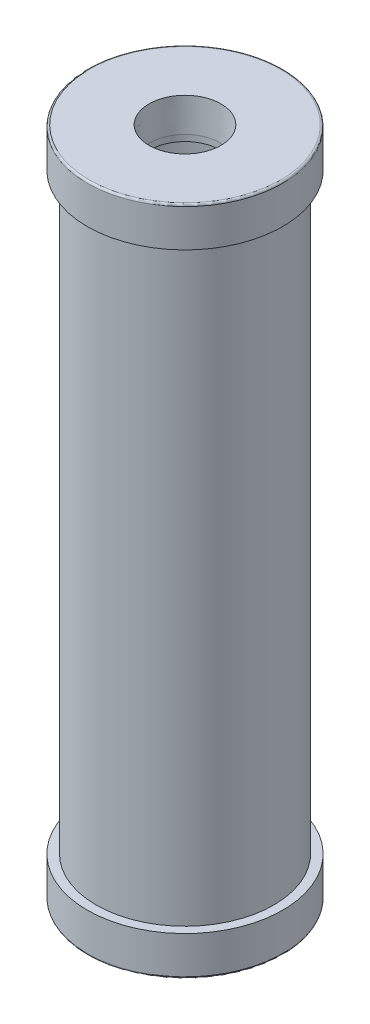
SolidWorks part; units mm, degrees
ref_plane "Front Plane" through (0, 0, 0) normal (0, 0, 1) x (1, 0, 0)
ref_plane "Top Plane" through (0, 0, 0) normal (0, 1, 0) x (1, 0, 0)
ref_plane "Right Plane" through (0, 0, 0) normal (1, 0, 0) x (0, 0, -1)
sketch "Sketch1" plane through (0, 0, 0) normal (0, 1, 0) x (1, 0, 0)
  circle A0 centre (0, 0) radius 57.15
  circle A1 centre (0, 0) radius 50.546
  dimension "D1" = 114.3
  dimension "D2" = 6.604
extrude "Boss-Extrude1" add sketch "Sketch1" along normal blind 431.8
sketch "Sketch2" plane through (0, 0, 0) normal (0, 1, 0) x (1, 0, 0)
  circle A0 centre (0, 0) radius 62.865
  dimension "D1" = 125.73
extrude "Boss-Extrude2" add sketch "Sketch2" along normal blind 25.4
hole_wizard "1-1/2 Rc Tapped Hole1" positions "Sketch4" profile "Sketch3" size "1-1/2" standard "BSI"
sketch "Sketch4" plane through (0, 0, 0) normal (0, 1, 0) x (1, 0, 0)
  point P0 (0, 0)
sketch "Sketch3" plane through (0, 0, 0) normal (1, 0, 0) x (0, 0, -1)
  line L0 (0, 0) -> (0, 46.3454)
  line L1 (22.6, 32.766) -> (0, 46.3454)
  line L2 (-22.6, 32.766) -> (0, 46.3454) construction
  line L3 (22.6, 32.766) -> (22.6, 21.336)
  line L4 (22.6, 21.336) -> (22.494, 21.336)
  line L5 (22.494, 21.336) -> (23.16, 0)
  line L6 (-22.494, 21.336) -> (-23.16, 0) construction
  line L7 (23.16, 0) -> (0, 0)
  line L8 (0, -6.35) -> (0, 107.95) construction
  line L11 (-22.6, 21.336) -> (-22.494, 21.336) construction
  dimension "Tap Drill Dia." = 45.2
  dimension "Tap Drill Depth" = 32.766
  dimension "Thread Dia." = 46.32
  dimension "Thread Angle" = 3.576
  dimension "Thread Depth" = 21.336
  dimension "Drill Angle" = 118
ref_plane "Plane1" through (0, 431.8, 0) normal (0, 1, 0) x (1, 0, 0)
sketch "Sketch5" plane through (0, 431.8, 0) normal (0, 1, 0) x (1, 0, 0)
  circle A0 centre (0, 0) radius 62.865
  dimension "D1" = 125.73
extrude "Boss-Extrude3" add sketch "Sketch5" against normal blind 25.4
hole_wizard "1-1/2 Rc Tapped Hole2" positions "Sketch7" profile "Sketch6" size "1-1/2" standard "BSI"
sketch "Sketch7" plane through (0, 431.8, 0) normal (0, 1, 0) x (1, 0, 0)
  point P0 (0, 0)
sketch "Sketch6" plane through (0, 431.8, 0) normal (1, 0, 0) x (0, 0, 1)
  line L0 (0, 0) -> (0, 46.3454)
  line L1 (22.6, 32.766) -> (0, 46.3454)
  line L2 (-22.6, 32.766) -> (0, 46.3454) construction
  line L3 (22.6, 32.766) -> (22.6, 21.336)
  line L4 (22.6, 21.336) -> (22.494, 21.336)
  line L5 (22.494, 21.336) -> (23.16, 0)
  line L6 (-22.494, 21.336) -> (-23.16, 0) construction
  line L7 (23.16, 0) -> (0, 0)
  line L8 (0, -6.35) -> (0, 107.95) construction
  line L11 (-22.6, 21.336) -> (-22.494, 21.336) construction
  dimension "Tap Drill Dia." = 45.2
  dimension "Tap Drill Depth" = 32.766
  dimension "Thread Dia." = 46.32
  dimension "Thread Angle" = 3.576
  dimension "Thread Depth" = 21.336
  dimension "Drill Angle" = 118
fillet "Fillet1" radius 1.27 2 edges at (0, 0, 62.865) (0, 431.8, 62.865)
